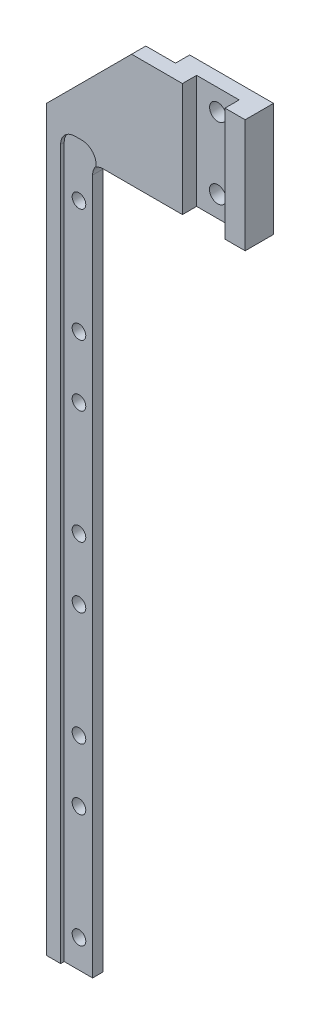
SolidWorks part; units mm, degrees
ref_plane "Front" through (0, 0, 0) normal (0, 0, 1) x (1, 0, 0)
ref_plane "Top" through (0, 0, 0) normal (0, 1, 0) x (1, 0, 0)
ref_plane "Right" through (0, 0, 0) normal (1, 0, 0) x (0, 0, -1)
sketch "Sketch1" plane through (0, 0, 0) normal (0, 0, 1) x (1, 0, 0)
  line L0 (-7.9375, 82.55) -> (-17.4625, 73.025)
  line L2 (-12.7, 69.85) -> (-12.7, -9.525)
  line L3 (-12.7, -9.525) -> (-17.4625, -9.525)
  line L4 (-17.4625, 73.025) -> (-17.4625, -9.525)
  line L5 (-12.7, 69.85) -> (4.7625, 69.85)
  line L7 (-7.9375, 82.55) -> (4.7625, 82.55)
  line L8 (4.7625, 69.85) -> (4.7625, 82.55)
  point P6 (-17.4625, 82.55)
  dimension "D1" = 9.525
  dimension "D2" = 12.7
  dimension "D3" = 92.075
  dimension "D4" = 22.225
  dimension "D5" = 12.7
  dimension "D6" = 17.4625
  dimension "D9" = 9.525
extrude "Extrude1" add sketch "Sketch1" along normal blind 3.175
fillet "Fillet2" radius 1.5875 1 edges at (-12.7, 69.85, 1.5875)
sketch "Sketch2" plane through (0, 0, 3.175) normal (0, 0, 1) x (1, 0, 0)
  line L0 (-12.7, -9.525) -> (-12.7, 68.2625) construction
  line L1 (-13.4937, 71.4375) -> (-14.2875, 71.4375)
  line L2 (-11.9062, 69.85) -> (-11.9062, -12.7)
  line L3 (-11.9062, -12.7) -> (-15.875, -12.7)
  line L4 (-15.875, 69.85) -> (-15.875, -12.7)
  line L5 (-11.1125, 69.85) -> (4.7625, 69.85) construction
  line L6 (-17.4625, -9.525) -> (-12.7, -9.525) construction
  arc A0 (-14.2875, 71.4375) -> (-15.875, 69.85) centre (-14.2875, 69.85) ccw
  arc A1 (-13.4937, 71.4375) -> (-11.9062, 69.85) centre (-13.4937, 69.85) cw
  dimension "D2" = 1.5875
  dimension "D4" = 1.5875
  dimension "D1" = 3.175
  dimension "D3" = 1.5875
  dimension "D5" = 3.9688
  dimension "D6" = 3.175
extrude "Cut-Extrude1" cut sketch "Sketch2" against normal blind 0.3969
hole_wizard "#0-80 Tapped Hole1" positions "Sketch4" profile "Sketch3" tap size "#0-80" standard "Ansi Inch"
sketch "Sketch4" plane through (0, 0, 2.7781) normal (0, 0, 1) x (1, 0, 0)
  point P1 (-14.224, 65.024)
  point P4 (-14.224, 52.324)
  point P7 (-14.224, 45.466)
  point P10 (-14.224, 32.766)
  point P13 (-14.224, 25.908)
  point P16 (-14.224, 13.208)
  point P19 (-14.224, 6.35)
  point P22 (-14.224, -6.35)
sketch "Sketch3" plane through (-14.224, 65.024, 2.7781) normal (1, 0, 0) x (0, -1, 0)
  line L0 (0, 0) -> (0, 2.7781)
  line L1 (0, 2.7781) -> (0.762, 2.7781)
  line L2 (0.762, 2.7781) -> (0.762, 0)
  line L5 (0.762, 0) -> (0, 0)
  line L11 (0, -6.35) -> (0, 107.95) construction
  dimension "Thread Major Dia." = 1.524
  dimension "Thru Tap Drill Depth" = 2.7781
sketch "Sketch6" plane through (-20.4458, 82.55, 0.7052) normal (0, 1, 0) x (-1, 0, 0)
  line L1 (-20.5728, 2.4698) -> (-20.5728, 2.0729) construction
  line L5 (-22.9541, 5.4463) -> (-18.1916, 5.4463)
  line L6 (-22.9541, 5.4463) -> (-22.9541, 0.8823)
  line L7 (-22.9541, 0.8823) -> (-18.1916, 0.8823)
  line L8 (-18.1916, 5.4463) -> (-18.1916, 0.8823)
  line L9 (-20.5728, 2.4698) -> (-20.5728, 2.0729) construction
  line L10 (-33.2728, 2.4698) -> (-4.6978, 2.4698) construction
  line L11 (-33.2728, 2.0729) -> (-4.6978, 2.0729) construction
  line L12 (-25.2083, 2.4698) -> (-12.5083, 2.4698) construction
  circle A0 centre (-20.5728, 2.2713) radius 3.175 construction
  point P3 (-20.5728, 2.2713)
  dimension "D1" = 6.35
  dimension "D2" = 1.5875
  dimension "D3" = 4.7625
  dimension "D4" = 2.3813
extrude "Cut-Extrude2" cut sketch "Sketch6" against normal through all
ref_plane "SHAFT CENTER" through (0, 0, 2.9766) normal (0, 0, 1) x (1, 0, 0)
sketch "Sketch7" plane through (0, 0, 0) normal (0, 0, -1) x (-1, 0, 0)
  line L0 (-0.127, 82.55) -> (-0.1075, 69.85) construction
  line L1 (11.1125, 69.85) -> (-4.7625, 69.85) construction
hole_wizard "#49 (0.073) Diameter Hole1" positions "Sketch9" profile "Sketch8" hole size "#49" standard "Ansi Inch"
sketch "Sketch9" plane through (0, 0, 0) normal (0, 0, -1) x (-1, 0, 0)
  line L0 (-0.127, 82.55) -> (-0.1075, 69.85) construction
  line L1 (-4.7625, 82.55) -> (7.9375, 82.55) construction
  line L2 (11.1125, 69.85) -> (-4.7625, 69.85) construction
  point P0 (-0.1111, 72.2122)
  point P1 (-0.1234, 80.1878)
  dimension "D1" = 2.3622
  dimension "D2" = 2.3622
  dimension "D3" = 7.9756
sketch "Sketch8" plane through (0.1111, 72.2122, 0) normal (1, 0, 0) x (0, 1, 0)
  line L0 (0, 0) -> (0, 3.175)
  line L1 (0, 3.175) -> (0.9271, 3.175)
  line L2 (0.9271, 3.175) -> (0.9271, 0)
  line L5 (0.9271, 0) -> (0, 0)
  line L11 (0, -6.35) -> (0, 107.95) construction
  dimension "Thru Hole Dia." = 1.8542
  dimension "Thru Hole Depth" = 3.175
sketch "Sketch10" plane through (0, -9.525, 0) normal (0, -1, 0) x (1, 0, 0)
  line L0 (-20.2754, 1.5875) -> (-4.6164, 1.5875)
  line L1 (-17.4625, 3.175) -> (-15.875, 3.175) construction
  line L2 (-4.6164, 1.5875) -> (-4.6164, -1.3552)
  line L3 (-4.6164, -1.3552) -> (-20.2754, -1.3552)
  line L4 (-20.2754, -1.3552) -> (-20.2754, 1.5875)
  line L5 (-2.2542, 1.5875) -> (-2.2542, 3.175) construction
  dimension "D1" = 1.5875
  dimension "D2" = 2.3622
extrude "Cut-Extrude3" cut sketch "Sketch10" against normal through all
